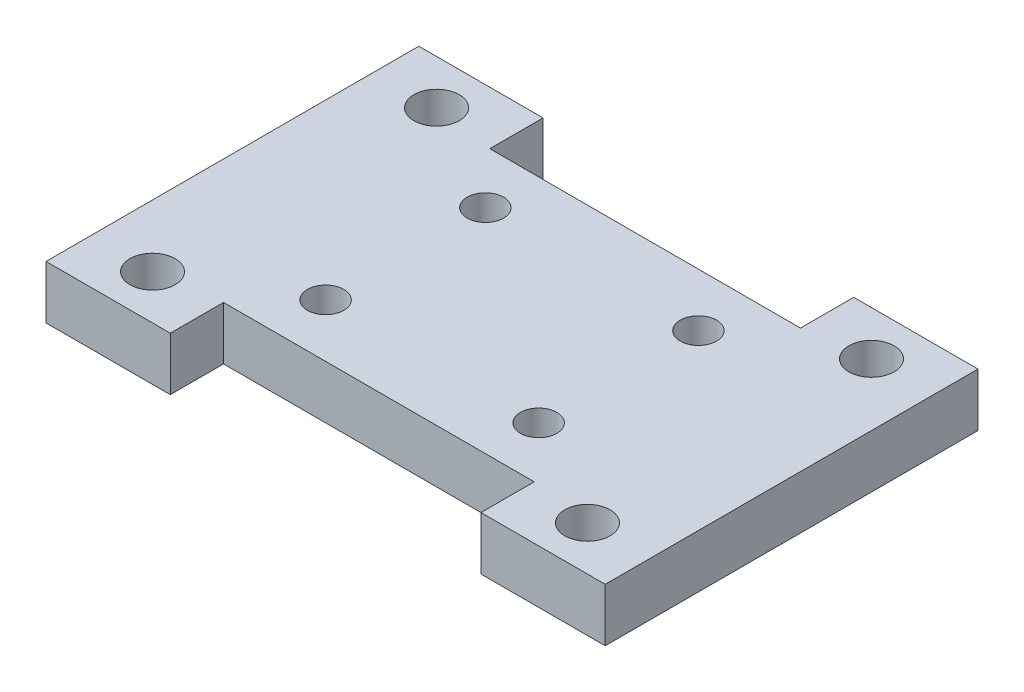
SolidWorks part; units mm, degrees
ref_plane "Front Plane" through (0, 0, 0) normal (0, 0, 1) x (1, 0, 0)
ref_plane "Top Plane" through (0, 0, 0) normal (0, 1, 0) x (1, 0, 0)
ref_plane "Right Plane" through (0, 0, 0) normal (1, 0, 0) x (0, 0, -1)
sketch "Sketch1" plane through (0, 0, 0) normal (0, 1, 0) x (1, 0, 0)
  line L0 (0, 15) -> (0, -15) construction
  line L1 (-17.5, -15) -> (17.5, -15)
  line L3 (-17.5, 15) -> (17.5, 15)
  line L5 (-17.5, -15) -> (17.5, 15) construction
  line L6 (-17.5, 15) -> (17.5, -15) construction
  line L7 (-24.4406, 0) -> (25.4895, 0) construction
  line L8 (17.5, 15) -> (17.5, 21)
  line L9 (17.5, 21) -> (31.5, 21)
  line L10 (31.5, 21) -> (31.5, -21)
  line L11 (31.5, -21) -> (17.5, -21)
  line L12 (17.5, -21) -> (17.5, -15)
  line L13 (-17.5, -21) -> (-17.5, -15)
  line L14 (-31.5, -21) -> (-17.5, -21)
  line L15 (-31.5, 21) -> (-31.5, -21)
  line L16 (-17.5, 21) -> (-31.5, 21)
  line L17 (-17.5, 15) -> (-17.5, 21)
  circle A0 centre (-12, 9) radius 2.05
  circle A1 centre (12, 9) radius 2.05
  circle A2 centre (12, -9) radius 2.05
  circle A3 centre (-12, -9) radius 2.05
  circle A4 centre (24.5, 16) radius 2.55
  circle A5 centre (24.5, -16) radius 2.55
  circle A6 centre (-24.5, -16) radius 2.55
  circle A7 centre (-24.5, 16) radius 2.55
  point P0 (0, 0)
  point P20 (31.5, 0)
  point P25 (24.5, 21)
  dimension "D3" = 4.1
  dimension "D11" = 5.1
  dimension "D1" = 35
  dimension "D2" = 30
  dimension "D4" = 12
  dimension "D5" = 9
  dimension "D6" = 14
  dimension "D7" = 42
  dimension "D8" = 14
  dimension "D9" = 35
  dimension "D10" = 16
extrude "Boss-Extrude1" add sketch "Sketch1" along normal blind 6
ref_plane "Plane1" through (0, 0, 0) normal (-1, 0, 0) x (0, 0, 1)
